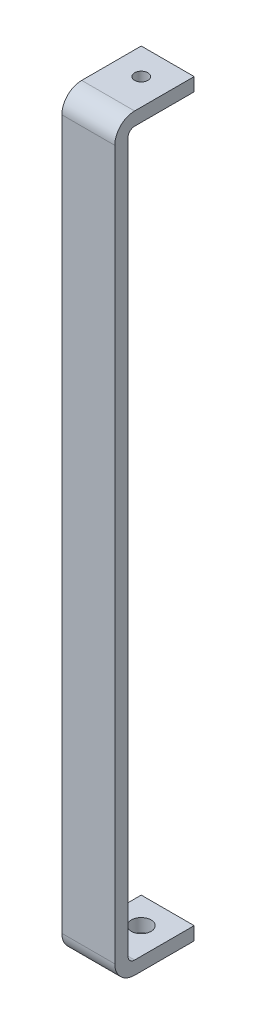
SolidWorks part; units mm, degrees
ref_plane "Front Plane" through (0, 0, 0) normal (0, 0, 1) x (1, 0, 0)
ref_plane "Top Plane" through (0, 0, 0) normal (0, 1, 0) x (1, 0, 0)
ref_plane "Right Plane" through (0, 0, 0) normal (1, 0, 0) x (0, 0, -1)
sketch "Sketch1" plane through (0, 0, 0) normal (0, 0, 1) x (1, 0, 0)
  line L0 (-20.6375, 3.175) -> (4.7625, 3.175) construction
  line L1 (-14.2875, 3.683) -> (-1.5875, 3.683)
  line L2 (-14.2875, 3.683) -> (-14.2875, 6.858)
  line L3 (-14.2875, 6.858) -> (-1.5875, 6.858)
  line L4 (-1.5875, 3.683) -> (-1.5875, 6.858)
  line L5 (-7.9375, 3.683) -> (-7.9375, -1.6508) construction
  dimension "D1" = 0.508
  dimension "D2" = 3.175
  dimension "D3" = 7.9375
  dimension "D4" = 12.7
extrude "Extrude1" add sketch "Sketch1" against normal blind 12.7 and the other way blind 3.175
sketch "Sketch2" plane through (0, 0, 3.175) normal (0, 0, 1) x (1, 0, 0)
  line L0 (4.7625, -169.545) -> (-20.6375, -169.545) construction
  line L1 (-14.2875, 6.858) -> (-1.5875, 6.858)
  line L2 (-14.2875, 6.858) -> (-14.2875, -172.72)
  line L3 (-14.2875, -172.72) -> (-1.5875, -172.72)
  line L4 (-1.5875, 6.858) -> (-1.5875, -172.72)
  line L6 (-1.5875, 3.683) -> (-1.5875, 6.858) construction
  dimension "D1" = 3.175
extrude "Extrude2" add sketch "Sketch2" along normal blind 3.175
sketch "Sketch3" plane through (0, 0, 3.175) normal (0, 0, -1) x (-1, 0, 0)
  line L0 (14.2875, 3.683) -> (14.2875, -172.72) construction
  line L1 (1.5875, -172.72) -> (14.2875, -172.72)
  line L2 (1.5875, -172.72) -> (1.5875, -169.545)
  line L3 (1.5875, -169.545) -> (14.2875, -169.545)
  line L4 (14.2875, -172.72) -> (14.2875, -169.545)
  dimension "D1" = 3.175
extrude "Extrude3" add sketch "Sketch3" along normal blind 15.875
sketch "Sketch4" plane through (0, -172.72, 0) normal (0, -1, 0) x (1, 0, 0)
  line L0 (5.227, -6.35) -> (-21.102, -6.35) construction
  line L1 (-7.9375, 6.35) -> (-7.9375, -14.2685) construction
  line L2 (-14.2875, 6.35) -> (-1.5875, 6.35) construction
  line L3 (-1.5875, -12.7) -> (-14.2875, -12.7) construction
  circle A0 centre (-7.9375, -6.35) radius 2.3749
  dimension "D1" = 4.7498
  dimension "D2" = 6.35
extrude "Cut-Extrude1" cut sketch "Sketch4" against normal blind 12.7
sketch "Sketch5" plane through (0, 6.858, 0) normal (0, 1, 0) x (-1, 0, 0)
  circle A0 centre (7.9375, -6.35) radius 1.5875
  dimension "D1" = 3.175
extrude "Cut-Extrude2" cut sketch "Sketch5" against normal blind 12.7
fillet "Fillet1" radius 1.5875 2 edges at (-7.9375, -169.545, 3.175)
fillet "Fillet2" radius 4.7625 2 edges at (-7.9375, 6.858, 6.35) (-7.9375, -172.72, 6.35)
